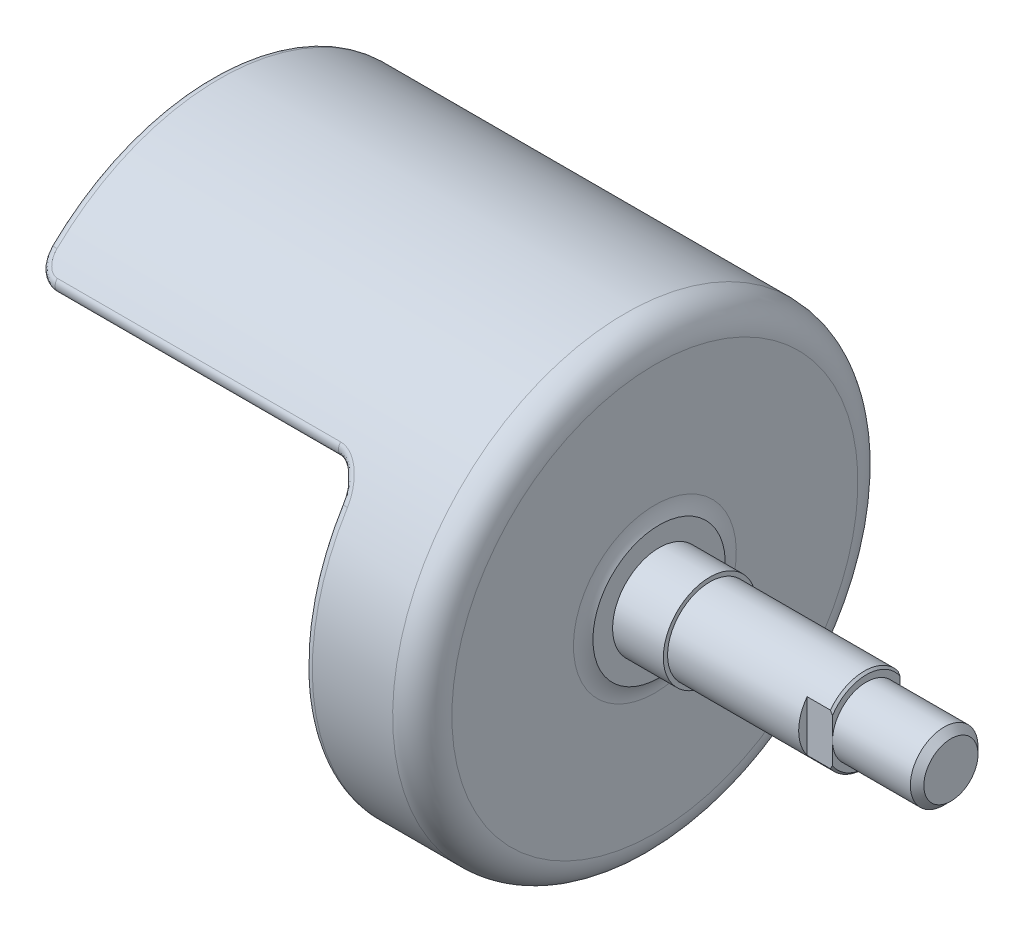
SolidWorks part; units mm, degrees
ref_plane "Plan de face" through (0, 0, 0) normal (0, 0, 1) x (1, 0, 0)
ref_plane "Plan de dessus" through (0, 0, 0) normal (0, 1, 0) x (1, 0, 0)
ref_plane "Plan de droite" through (0, 0, 0) normal (1, 0, 0) x (0, 0, -1)
sketch "Esquisse1" plane through (0, 0, 0) normal (0, 0, 1) x (1, 0, 0)
  line L0 (0, 50) -> (0, 55)
  line L1 (0, 55) -> (105, 55)
  line L2 (105, 55) -> (105, 12.5)
  line L3 (105, 12.5) -> (175, 10)
  line L4 (175, 10) -> (175, 0)
  line L5 (0, 0) -> (175, 0) construction
  line L6 (0, 50) -> (100, 50)
  line L7 (100, 50) -> (100, 0)
  line L8 (175, 0) -> (100, 0)
  dimension "D1" = 100
  dimension "D2" = 110
  dimension "D3" = 5
  dimension "D4" = 25
  dimension "D5" = 20
  dimension "D6" = 105
  dimension "D7" = 70
revolve "Révolution1" add sketch "Esquisse1" angle 360 about L5
sketch "Esquisse2" plane through (0, 0, 0) normal (0, 0, 1) x (1, 0, 0)
  line L0 (0, -55) -> (0, 33)
  line L1 (0, 33) -> (77, 33)
  line L2 (77, 33) -> (77, -55)
  line L3 (77, -55) -> (0, -55)
  line L4 (0, 55) -> (0, -55) construction
  line L5 (0, -55) -> (105, -55) construction
  line L6 (105, -55) -> (105, 55) construction
  dimension "D1" = 28
  dimension "D2" = 33
extrude "Extrusion1" cut sketch "Esquisse2" against normal through all and the other way through all
fillet "Congé3" radius 5 4 edges at (0, 33, -40.7816) (0, 33, 40.7816) (77, 33, 40.7816) (77, 33, -40.7816)
fillet "Congé1" radius 7 2 edges at (105, -12.5, 0) (105, -55, 0)
fillet "Congé5" radius 2 16 edges at (2.4725, 33.6859, 36.9494) (38.5, 33, 37.5633) (75.332, 31.728, 38.6437) (77, -50, 0) (74.5765, 32.2851, -38.1795) (38.5, 33, -37.5633) (1.5545, 34.3766, -36.3077) (1.285, 34.6535, 42.7099) (38.5, 33, 44) (74.6808, 32.2206, 44.5739) (77, -55, 0) (75.3267, 31.7327, -44.9225) (38.5, 33, -44) (2.3582, 33.7549, -43.4236) (0, 50, 0) (0, 55, 0)
fillet "Congé6" radius 2 2 edges at (100, -50, 0) (175, -10, 0)
sketch "Esquisse4" plane through (0, 0, 0) normal (0, 0, 1) x (1, 0, 0)
  line L0 (106, 22.86) -> (175, 22.86)
  line L1 (105, -48) -> (105, 48) construction
  line L2 (175, 8) -> (155, 8)
  line L3 (155, 8) -> (155, 10)
  line L4 (155, 10) -> (118, 10)
  line L5 (106, 11) -> (106, 22.86)
  line L6 (118, 10) -> (118, 11)
  line L7 (118, 11) -> (106, 11)
  line L8 (175, 8) -> (175, 22.86)
  line L9 (175, -8.0702) -> (175, 8.0702) construction
  line L11 (58.0086, 0) -> (159.1696, 0) construction
  arc A5 (105, 19.2545) -> (111.7502, 12.2589) centre (112, 19.2545) ccw construction
  dimension "D1" = 1
  dimension "D2" = 13
  dimension "D3" = 37
  dimension "D4" = 22
  dimension "D5" = 20
  dimension "D6" = 16
revolve "Enlèvement de matière-Révolution1" cut sketch "Esquisse4" angle 360 about L11
chamfer "Chanfrein1" distance 1.6 angle 45 1 edges at (175, 0, 8)
chamfer "Chanfrein2" distance 0.5 angle 45 1 edges at (155, 0, 10)
sketch "Esquisse5" plane through (155, 0, 0) normal (1, 0, 0) x (0, 0, -1)
  line L0 (-8, 6) -> (-8, -6)
  arc A0 (-8, 6) -> (-8, -6) centre (0, 0) ccw
  circle A1 centre (0, 0) radius 10 construction
  circle A2 centre (0, 0) radius 8 construction
extrude "Extrusion2" cut sketch "Esquisse5" against normal blind 6
mirror "Symétrie1" about plane through (0, 0, 0) normal (0, 0, 1) of "Extrusion2"
